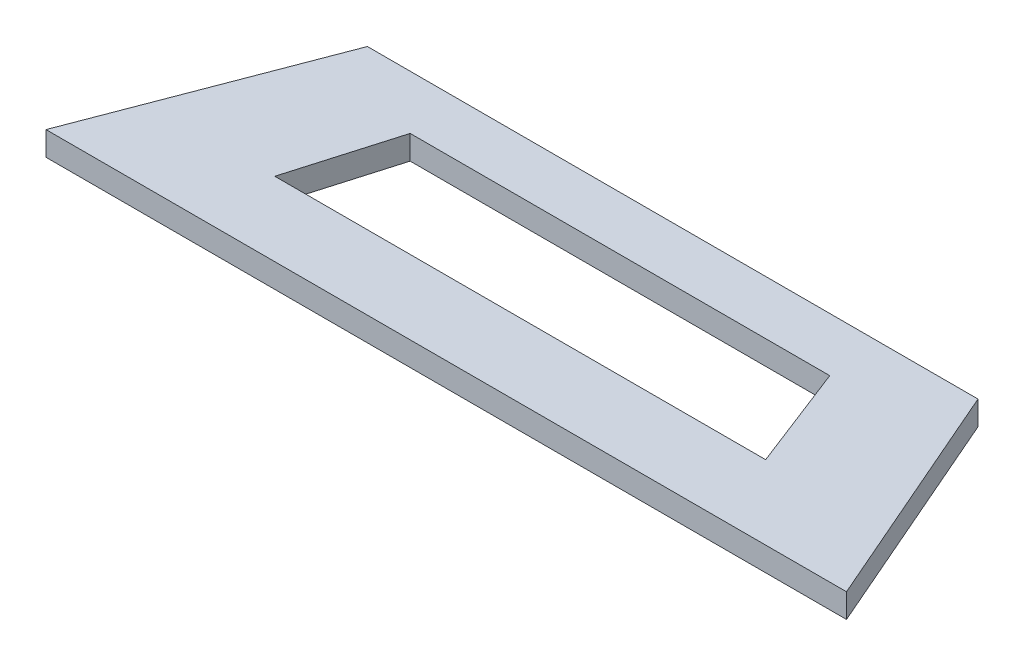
SolidWorks part; units mm, degrees
ref_plane "Plan de face" through (0, 0, 0) normal (0, 0, 1) x (1, 0, 0)
ref_plane "Plan de dessus" through (0, 0, 0) normal (0, 1, 0) x (1, 0, 0)
ref_plane "Plan de droite" through (0, 0, 0) normal (1, 0, 0) x (0, 0, -1)
sketch "Esquisse1" plane through (0, 0, 0) normal (0, 1, 0) x (1, 0, 0)
  line L0 (0, 0) -> (100, 0)
  line L1 (100, 0) -> (87.3641, 29.0627)
  line L2 (87.3641, 29.0627) -> (11.0889, 29.0627)
  line L3 (11.0889, 29.0627) -> (0, 0)
  dimension "D1" = 100
extrude "Boss.-Extru.1" add sketch "Esquisse1" along normal blind 3
sketch "Esquisse2" plane through (0, 3, 0) normal (0, 1, 0) x (1, 0, 0)
  line L0 (19.3394, 9.2394) -> (60.9112, 9.2394)
  line L1 (60.9112, 9.2394) -> (80.6606, 9.2394)
  line L2 (80.6606, 9.2394) -> (75.5747, 22.3329)
  line L3 (75.5747, 22.3329) -> (23.1583, 22.3329)
  line L4 (23.1583, 22.3329) -> (19.3394, 9.2394)
  point P5 (75.5323, 22.442)
  point P6 (23.1583, 22.3329)
extrude "Enlèv. mat.-Extru.1" cut sketch "Esquisse2" against normal up to next
